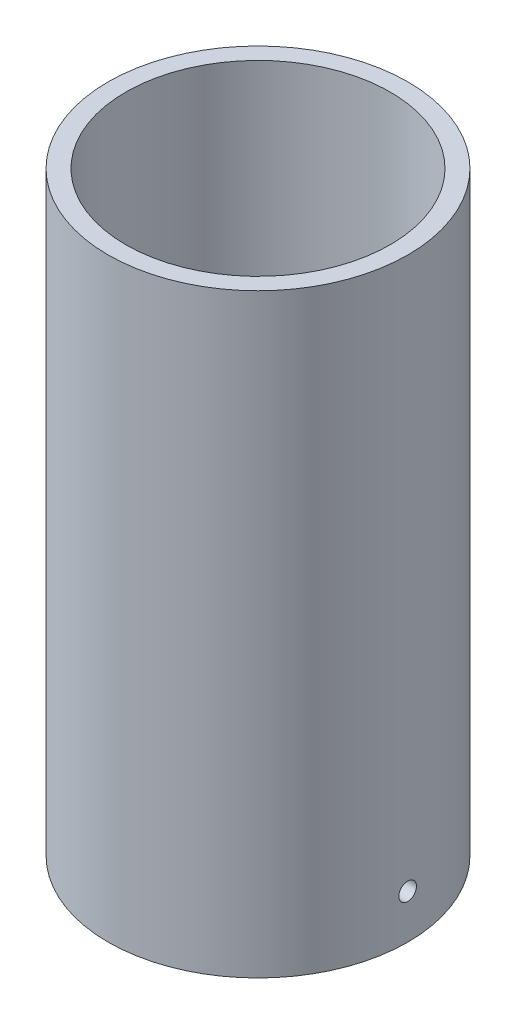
SolidWorks part; units mm, degrees
ref_plane "Front Plane" through (0, 0, 0) normal (0, 0, 1) x (1, 0, 0)
ref_plane "Top Plane" through (0, 0, 0) normal (0, 1, 0) x (1, 0, 0)
ref_plane "Right Plane" through (0, 0, 0) normal (1, 0, 0) x (0, 0, -1)
sketch "Sketch1" plane through (0, 0, 0) normal (0, 1, 0) x (1, 0, 0)
  circle A0 centre (0, 0) radius 43.18
extrude "Boss-Extrude1" add sketch "Sketch1" along normal blind 171.45
sketch "Sketch2" plane through (0, 171.45, 0) normal (0, 1, 0) x (1, 0, 0)
  circle A0 centre (0, 0) radius 38.1
extrude "Cut-Extrude1" cut sketch "Sketch2" against normal through all
ref_plane "Plane1" through (43.18, 0, 0) normal (1, 0, 0) x (0, 0, -1)
sketch "Sketch3" plane through (43.18, 0, 0) normal (1, 0, 0) x (0, 0, -1)
  circle A0 centre (0, 12.7) radius 2.54
extrude "Cut-Extrude2" cut sketch "Sketch3" against normal up to next and the other way through all
